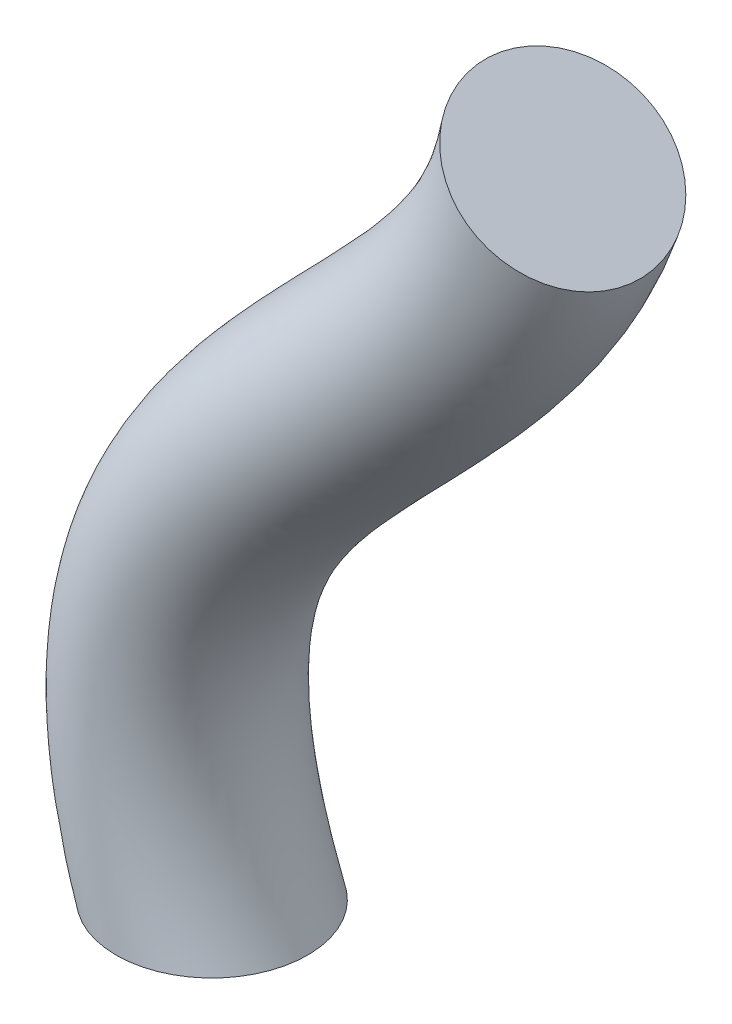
SolidWorks part; units mm, degrees
ref_plane "Front Plane" through (0, 0, 0) normal (0, 0, 1) x (1, 0, 0)
ref_plane "Top Plane" through (0, 0, 0) normal (0, 1, 0) x (1, 0, 0)
ref_plane "Right Plane" through (0, 0, 0) normal (1, 0, 0) x (0, 0, -1)
sketch "Sketch1" plane through (0, 0, 0) normal (0, 0, 1) x (1, 0, 0)
  spline S0 degree 3 poles (0, 0) (-14.1885, 38.3252) (24.3526, 46.8023) (32.082, 73.9264) knots 0 0 0 0 1 1 1 1
  point P2 (0, 0)
sketch "Sketch3" plane through (0, 0, 0) normal (0, 1, 0) x (1, 0, 0)
  circle A0 centre (0, 0) radius 8.7606
  dimension "D1" = 17.5211
sweep "Sweep1" add profiles "Sketch3" path "Sketch1"
